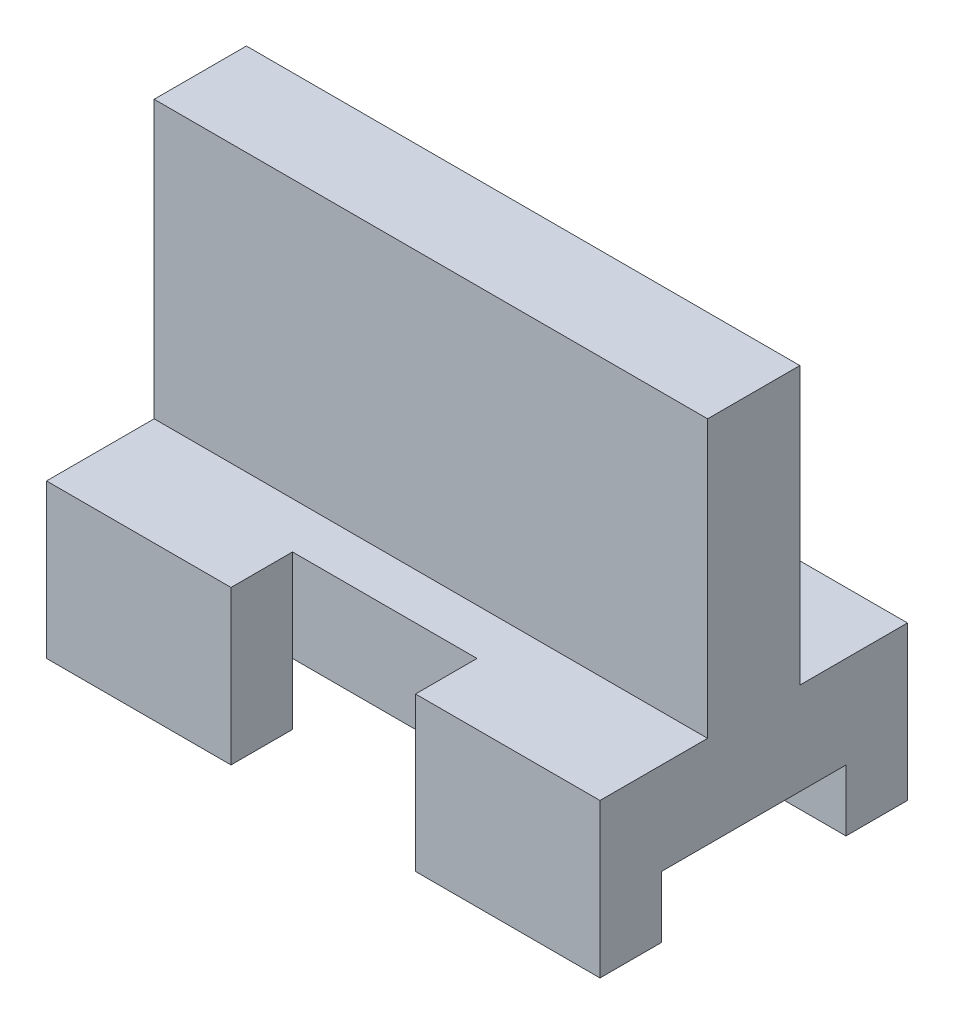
SolidWorks part; units mm, degrees
ref_plane "前视基准面" through (0, 0, 0) normal (0, 0, 1) x (1, 0, 0)
ref_plane "上视基准面" through (0, 0, 0) normal (0, 1, 0) x (1, 0, 0)
ref_plane "右视基准面" through (0, 0, 0) normal (1, 0, 0) x (0, 0, -1)
sketch "草图1" plane through (0, 0, 0) normal (0, 1, 0) x (1, 0, 0)
  line L1 (0, 0) -> (90, 0)
  line L2 (0, 0) -> (0, 50)
  line L3 (0, 50) -> (90, 50)
  line L4 (90, 0) -> (90, 50)
  dimension "D1" = 90
  dimension "D2" = 50
extrude "拉伸1" add sketch "草图1" along normal blind 25
sketch "草图2" plane through (0, 25, 0) normal (0, 1, 0) x (1, 0, 0)
  line L0 (0, 50) -> (0, 0) construction
  line L1 (0, 32.5) -> (90, 32.5)
  line L2 (0, 32.5) -> (0, 17.5)
  line L3 (0, 17.5) -> (90, 17.5)
  line L4 (90, 32.5) -> (90, 17.5)
  line L5 (90, 0) -> (90, 50) construction
  line L6 (90, 25) -> (79.6264, 25) construction
  dimension "D1" = 15
extrude "拉伸2" add sketch "草图2" along normal blind 45
sketch "草图3" plane through (0, 25, 0) normal (0, 1, 0) x (1, 0, 0)
  line L0 (0, 0) -> (90, 0) construction
  line L1 (30, 0) -> (60, 0)
  line L2 (30, 0) -> (30, 10)
  line L3 (30, 10) -> (60, 10)
  line L4 (60, 0) -> (60, 10)
  line L5 (90, 25) -> (34.6552, 25) construction
  line L6 (90, 17.5) -> (90, 32.5) construction
  line L8 (45, 0) -> (45, -6.3219) construction
  line L9 (45, 50) -> (45, 56.3219) construction
  line L10 (60, 50) -> (60, 40)
  line L11 (30, 40) -> (60, 40)
  line L12 (30, 50) -> (30, 40)
  line L13 (30, 50) -> (60, 50)
  dimension "D1" = 10
  dimension "D2" = 30
extrude "切除-拉伸1" cut sketch "草图3" against normal through all
sketch "草图4" plane through (90, 0, 0) normal (1, 0, 0) x (0, 0, -1)
  line L0 (0, 0) -> (50, 0) construction
  line L1 (10, 0) -> (40, 0)
  line L2 (10, 0) -> (10, 10)
  line L3 (10, 10) -> (40, 10)
  line L4 (40, 0) -> (40, 10)
  line L5 (25, 0) -> (25, 5.426) construction
  dimension "D1" = 10
  dimension "D2" = 30
extrude "切除-拉伸2" cut sketch "草图4" against normal through all
